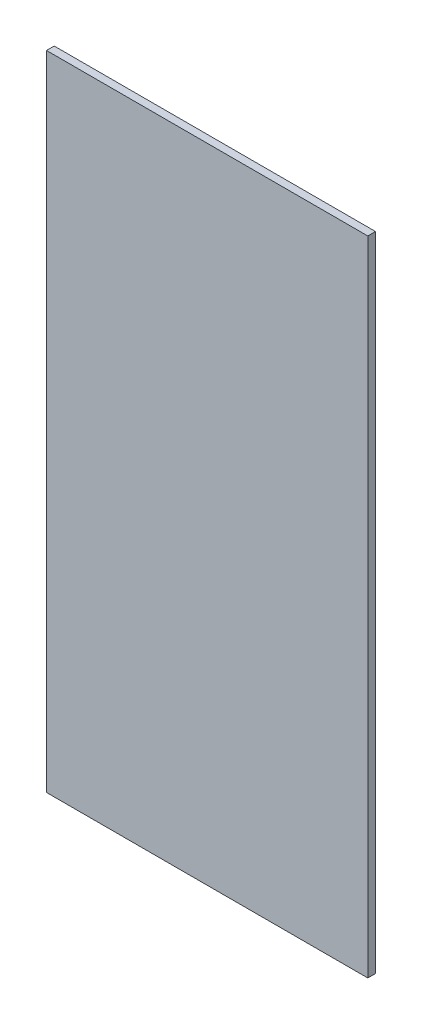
SolidWorks part; units mm, degrees
ref_plane "Plano frontal" through (0, 0, 0) normal (0, 0, 1) x (1, 0, 0)
ref_plane "Plano superior" through (0, 0, 0) normal (0, 1, 0) x (1, 0, 0)
ref_plane "Plano direito" through (0, 0, 0) normal (1, 0, 0) x (0, 0, -1)
sketch "Esboço1" plane through (0, 0, 0) normal (0, 0, 1) x (1, 0, 0)
  line L1 (0, 0) -> (250, 0)
  line L2 (0, 0) -> (0, -500)
  line L3 (0, -500) -> (250, -500)
  line L4 (250, 0) -> (250, -500)
extrude "Ressalto-extrusão1" add sketch "Esboço1" along normal blind 6
